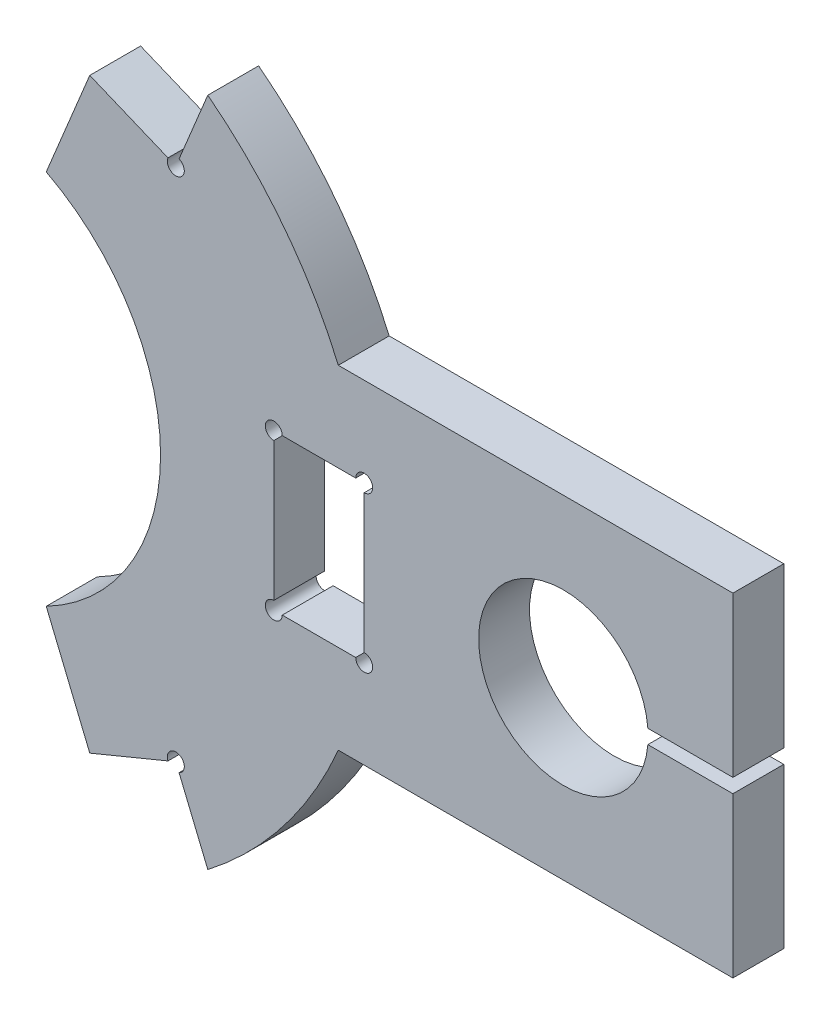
SolidWorks part; units mm, degrees
ref_plane "Front Plane" through (0, 0, 0) normal (0, 0, 1) x (1, 0, 0)
ref_plane "Top Plane" through (0, 0, 0) normal (0, 1, 0) x (1, 0, 0)
ref_plane "Right Plane" through (0, 0, 0) normal (1, 0, 0) x (0, 0, -1)
sketch "Sketch3" plane through (0, 0, 0) normal (0, 0, 1) x (1, 0, 0)
  line L0 (90.828, 118.6888) -> (79.5105, 91.2924)
  line L1 (79.5105, 91.2924) -> (49.0512, 103.8753)
  line L2 (49.0512, 103.8753) -> (33.6422, 66.575)
  line L3 (-0.8943, 0) -> (56.8997, 0) construction
  line L4 (49.0512, -103.8753) -> (33.6422, -66.575)
  line L5 (79.5105, -91.2924) -> (49.0512, -103.8753)
  line L6 (90.828, -118.6888) -> (79.5105, -91.2924)
  line L7 (137.0194, -58.99) -> (276.6922, -58.99)
  line L8 (137.0194, 58.99) -> (276.6922, 58.99)
  line L11 (276.6922, 58.99) -> (276.6922, -58.99)
  arc A2 (90.828, -118.6888) -> (137.0194, -58.99) centre (-0.8943, 0) ccw
  arc A3 (33.6422, -66.575) -> (33.6422, 66.575) centre (-0.8943, 0) ccw
  arc A4 (137.0194, 58.99) -> (90.828, 118.6888) centre (-0.8943, 0) ccw
  dimension "D1" = 75
  dimension "D2" = 150
  dimension "D7" = 46.1914
  dimension "D3" = 117.9801
  dimension "D4" = 139.6729
  dimension "D5" = 115.0754
  dimension "D6" = 32.956
  dimension "D8" = 67.554
extrude "Boss-Extrude1" add sketch "Sketch3" along normal blind 18
sketch "Sketch4" plane through (0, 0, 0) normal (0, 0, -1) x (-1, 0, 0)
  line L0 (-27.9671, 0) -> (-60.2983, 0) construction
  line L3 (-276.6922, -58.99) -> (-276.6922, 58.99) construction
  line L5 (-246.5879, 2.5) -> (-276.6922, 2.5)
  line L7 (-246.5879, -2.5) -> (-276.6922, -2.5)
  line L8 (-276.6922, 2.5) -> (-276.6922, -2.5)
  arc A0 (-246.5879, -2.5) -> (-246.5879, 2.5) centre (-216.6922, 0) ccw
  point P5 (-261.6401, -2.5)
  dimension "D1" = 60
  dimension "D2" = 60
  dimension "D3" = 5
extrude "Cut-Extrude1" cut sketch "Sketch4" against normal through all
sketch "Sketch5" plane through (0, 0, 0) normal (0, 0, -1) x (-1, 0, 0)
  line L0 (-146.1827, -27.5) -> (-146.1827, 27.5)
  line L1 (-146.1827, 27.5) -> (-114.1827, 27.5)
  line L2 (-114.1827, 27.5) -> (-114.1827, -27.5)
  line L3 (-114.1827, -27.5) -> (-146.1827, -27.5)
  line L4 (-276.6922, 58.99) -> (-137.0194, 58.99) construction
extrude "Cut-Extrude2" cut sketch "Sketch5" against normal through all
sketch "Sketch6" plane through (0, 0, 0) normal (0, 0, -1) x (-1, 0, 0)
  circle A0 centre (-79.5105, 91.2924) radius 3
  circle A1 centre (-114.1827, 27.5) radius 3
  circle A2 centre (-146.1827, 27.5) radius 3
  circle A3 centre (-114.1827, -27.5) radius 3
  circle A4 centre (-146.1827, -27.5) radius 3
  circle A5 centre (-79.5105, -91.2924) radius 3
  dimension "D1" = 6
extrude "Cut-Extrude3" cut sketch "Sketch6" against normal through all
